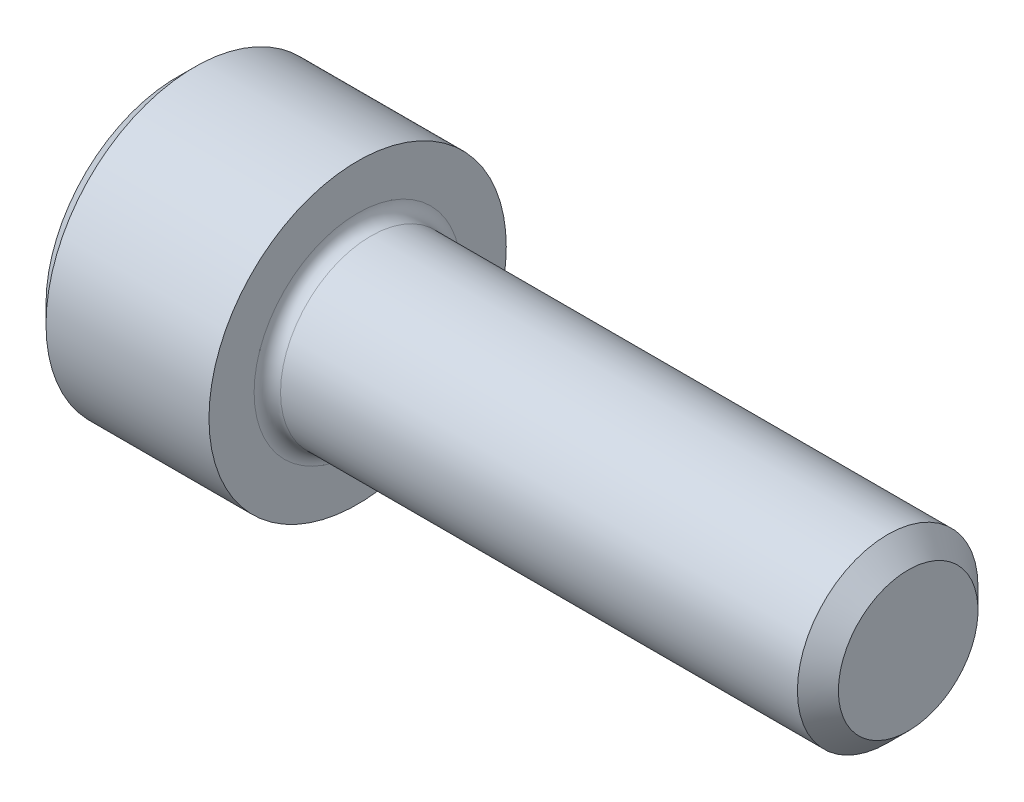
SolidWorks part; units mm, degrees
revolve "Base-Revolve" add sketch "BodySke"
sketch "BodySke" plane through (0, 0, 0) normal (0, 0, 1) x (1, 0, 0)
  line L0 (0, 0) -> (0, 3.0226)
  line L1 (0.4064, 3.429) -> (4.1656, 3.429)
  line L2 (4.1656, 3.429) -> (4.1656, 2.0828)
  line L3 (4.1656, 2.0828) -> (16.3932, 2.0828)
  line L4 (16.8656, 1.6104) -> (16.8656, 0)
  line L5 (16.8656, 0) -> (0, 0)
  line L6 (-31.75, 0) -> (127, 0) construction
  line L7 (0, 3.0226) -> (0.4064, 3.429)
  line L8 (16.8656, 1.6104) -> (16.3932, 2.0828)
  line L9 (0, -3.0226) -> (0.4064, -3.429) construction
  line L10 (16.8656, -1.6104) -> (16.3932, -2.0828) construction
  line L11 (4.9581, 9.525) -> (4.9581, 3.175) construction
  line L12 (4.1656, 9.525) -> (4.1656, 3.175) construction
  line L13 (-21.2344, 9.525) -> (-21.2344, 3.175) construction
  dimension "Diameter" = 4.1656
  dimension "Head_ht" = 4.1656
  dimension "Length" = 12.7
  dimension "Body_ch_ang" = 45
  dimension "Head_dia" = 6.858
  dimension "Head_ch_ang" = 45
  dimension "Head_side_ht" = 3.7592
  dimension "Minor_dia" = 3.2207
  dimension "Advance" = 0.7925
  dimension "Thread_nom" = 12.7
  dimension "Thread_length" = 38.1
fillet "Fillet1" radius 0.3048 1 edges at (4.1656, 0, 2.0828)
ref_plane "Plane1" through (0, 0, 0) normal (0, 0, 1) x (1, 0, 0)
ref_plane "Plane2" through (0, 0, 0) normal (0, 1, 0) x (1, 0, 0)
ref_plane "Plane3" through (0, 0, 0) normal (1, 0, 0) x (0, 0, -1)
sketch "Sketch2" plane through (0, 0, 0) normal (0, 0, 1) x (1, 0, 0)
  line L0 (0, 1.778) -> (1.9558, 1.778)
  line L1 (1.9558, 1.778) -> (2.9823, 0)
  line L2 (-31.75, 0) -> (127, 0) construction
  line L3 (2.9823, 0) -> (0, 0)
  line L4 (0, 0) -> (0, 1.778)
  line L5 (0, 3.0226) -> (0, -3.0226) construction
  line L6 (0, 0) -> (47.625, 0) construction
  line L7 (4.1656, -3.429) -> (4.1656, 3.429) construction
revolve "Hex-PreBroach" cut sketch "Sketch2" angle 360 about L6
sketch "Sketch3" plane through (0, 0, 0) normal (-1, 0, 0) x (0, 0.5, 0.866)
  line L0 (1.0265, 1.778) -> (-1.0265, 1.778)
  line L1 (-1.0265, 1.778) -> (-2.0531, 0)
  line L2 (1.0265, 1.778) -> (2.0531, 0)
  line L3 (1.0265, -1.778) -> (2.0531, 0)
  line L4 (1.0265, -1.778) -> (-1.0265, -1.778)
  line L5 (-1.0265, -1.778) -> (-2.0531, 0)
extrude "Hex" cut sketch "Sketch3" against normal blind 1.9558
sketch "Sketch4" plane through (0, 0, 0) normal (-1, 0, 0) x (0, 0, 1)
  line L0 (0, 0) -> (2.1971, 0)
  line L1 (0, 0) -> (6.1484, 3.5498) construction
  line L2 (0, 0) -> (1.0985, 1.9027)
  line L3 (1.8302, 0.5287) -> (2.0897, 0.6786)
  line L4 (1.373, 1.3206) -> (1.6325, 1.4704)
  arc A0 (1.8302, 0.5287) -> (1.373, 1.3206) centre (0, 0) ccw
  arc A1 (2.1971, 0) -> (2.0897, 0.6786) centre (0, 0) ccw
  arc A2 (1.0985, 1.9027) -> (1.6325, 1.4704) centre (0, 0) cw
extrude "Spline" [suppressed] cut sketch "Sketch4" against normal blind 1.9558
pattern_circular "CirPattern1" [suppressed] count 6 every 60
sketch "Sketch5" plane through (0, 0, 0) normal (0, 0, 1) x (1, 0, 0)
  line L0 (-31.75, 0) -> (127, 0) construction
  line L2 (0, 3.0226) -> (0, -3.0226) construction
  circle A0 centre (1.524, 0) radius 0.5905
  dimension "Drilled_hole_dia" = 1.1811
  dimension "Drilled_hole_loc" = 1.524
extrude "Hole" [suppressed] cut sketch "Sketch5" against normal through all and the other way through all
pattern_circular "Drilled-4" [suppressed] count 2 every 60
pattern_circular "Drilled-6" [suppressed] count 3 every 60
sketch "ThdSchSke" plane through (0, 0, 0) normal (0, 0, 1) x (1, 0, 0)
  line L0 (4.9581, -1.6104) -> (4.6273, -2.0828)
  line L1 (4.9581, -1.6104) -> (5.2889, -2.0828)
  line L2 (5.2889, -2.0828) -> (5.2889, -2.6035)
  line L3 (-3.175, 0) -> (5.1513, 0) construction
  line L5 (5.2889, -2.6035) -> (4.6273, -2.6035)
  line L6 (4.6273, -2.6035) -> (4.6273, -2.0828)
  line L7 (0, 3.0226) -> (0, -3.0226) construction
revolve "ThreadSchematic" [suppressed] cut sketch "ThdSchSke" angle 360 about L3
pattern_linear "ThdSchPat" [suppressed]
equation "\"D2@Sketch3\" = \"Hex_size@Sketch3\" / 2"
equation "\"D1@Sketch3\" = \"Hex_size@Sketch3\" / 2"
equation "\"D1@Sketch2\" = \"Hex_size@Sketch3\" / 2"
equation "\"D3@Sketch4\" = \"Spline_p_dim@Sketch4\" / 2"
equation "\"Thread_minor@ThreadCosmetic\"  =  \"Minor_dia@BodySke\""
equation "\"D2@CirPattern1\" = 360 / \"Num_teeth@CirPattern1\""
equation "\"Wall_thickness@Sketch2\" = \"Head_ht@BodySke\" - \"Key_eng@Hex\""
equation "\"Thread_length@ThreadCosmetic\" = ((sgn( (\"Length@BodySke\" - \"Advance@BodySke\" ) - \"Thread_nom@BodySke\" )-1)*( (\"Length@BodySke\" - \"Advance@BodySke\" ) - \"Thread_nom@BodySke\" ))/-2+ \"Thread_nom@BodySke\""
equation "\"Thread_minor@ThdSchSke\" = \"Minor_dia@BodySke\""
equation "\"Diameter@ThdSchSke\" = \"Diameter@BodySke\""
equation "\"Overcut@ThdSchSke\" = \"Diameter@BodySke\" * 1.25"
equation "\"Start@ThdSchSke\" = \"Head_ht@BodySke\" + \"Length@BodySke\" - \"Thread_length@ThreadCosmetic\"  '---Non-countersunk---"
equation "\"Num_threads@ThdSchPat\" = int( \"Thread_length@ThreadCosmetic\" / \"Advance@BodySke\" + 0.999 )  + 1"
equation "\"Advance@ThdSchPat\" = \"Thread_length@ThreadCosmetic\" /  (\"Num_threads@ThdSchPat\" - 1) 'relax it"
equation "\"Num_threads@ThdSchPat\" = \"Num_threads@ThdSchPat\" - sgn( \"Num_threads@ThdSchPat\" - 1) '---chamfered tips only---"
